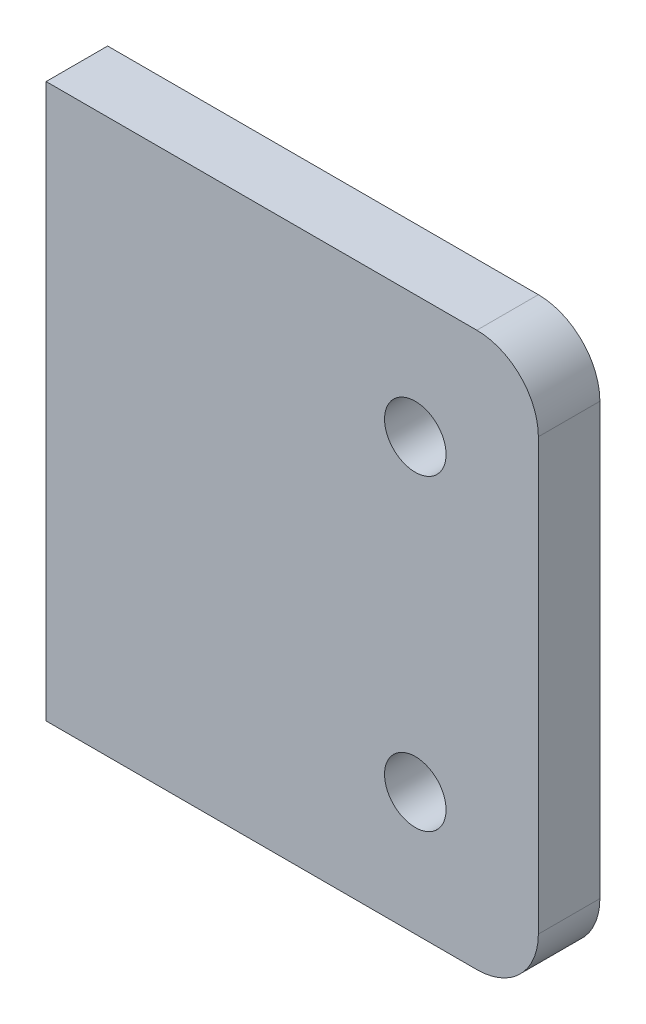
SolidWorks part; units mm, degrees
ref_plane "Front" through (0, 0, 0) normal (0, 0, 1) x (1, 0, 0)
ref_plane "Top" through (0, 0, 0) normal (0, 1, 0) x (1, 0, 0)
ref_plane "Right" through (0, 0, 0) normal (1, 0, 0) x (0, 0, -1)
sketch "Sketch1" plane through (0, 0, 0) normal (0, 0, 1) x (1, 0, 0)
  line L0 (0, 0) -> (50.8, 0) construction
  line L1 (0, 28.575) -> (44.45, 28.575)
  line L2 (0, 28.575) -> (0, -28.575)
  line L3 (0, -28.575) -> (44.45, -28.575)
  line L4 (50.8, 22.225) -> (50.8, -22.225)
  arc A0 (44.45, 28.575) -> (50.8, 22.225) centre (44.45, 22.225) cw
  arc A1 (44.45, -28.575) -> (50.8, -22.225) centre (44.45, -22.225) ccw
  circle A2 centre (38.1, 15.875) radius 3.175
  circle A3 centre (38.1, -15.875) radius 3.175
  point P6 (50.8, 28.575)
  point P9 (50.8, -28.575)
  dimension "D2" = 6.35
  dimension "D3" = 12.7
  dimension "D4" = 6.35
  dimension "D6" = 12.7
  dimension "D1" = 57.15
  dimension "D5" = 50.8
  dimension "D7" = 12.7
extrude "Extrude1" add sketch "Sketch1" along normal blind 6.35
